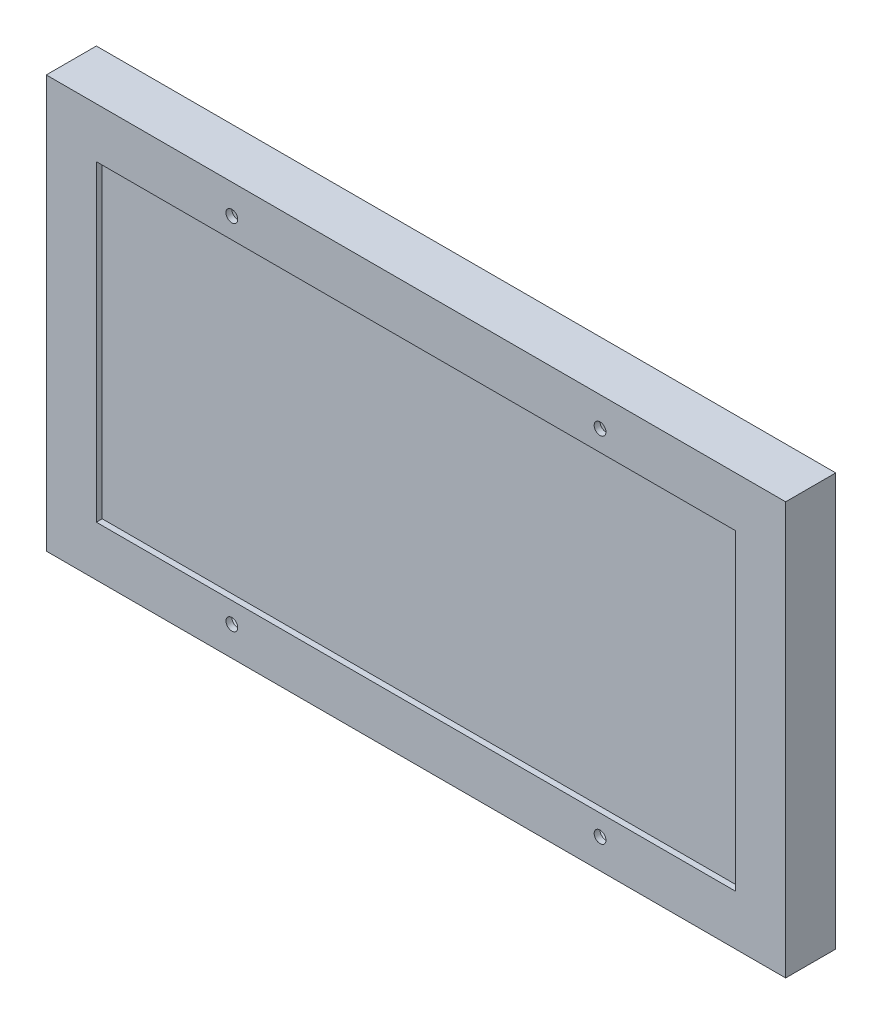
SolidWorks part; units mm, degrees
ref_plane "Front Plane" through (0, 0, 0) normal (0, 0, 1) x (1, 0, 0)
ref_plane "Top Plane" through (0, 0, 0) normal (0, 1, 0) x (1, 0, 0)
ref_plane "Right Plane" through (0, 0, 0) normal (1, 0, 0) x (0, 0, -1)
sketch "Sketch1" plane through (0, 0, 0) normal (0, 0, 1) x (1, 0, 0)
  line L1 (125.5, -70) -> (-125.5, -70)
  line L2 (125.5, -70) -> (125.5, 70)
  line L3 (125.5, 70) -> (-125.5, 70)
  line L4 (-125.5, -70) -> (-125.5, 70)
  line L5 (125.5, -70) -> (-125.5, 70) construction
  line L6 (125.5, 70) -> (-125.5, -70) construction
  point P0 (0, 0)
  dimension "D1" = 251
  dimension "D2" = 140
extrude "Boss-Extrude1" add sketch "Sketch1" along normal blind 17
sketch "Sketch2" plane through (0, 0, 17) normal (0, 0, 1) x (1, 0, 0)
  line L0 (125.5, 70) -> (-125.5, 70) construction
  line L1 (108.5, 53) -> (-108.5, 53)
  line L2 (108.5, 53) -> (108.5, -53)
  line L3 (108.5, -53) -> (-108.5, -53)
  line L4 (-108.5, 53) -> (-108.5, -53)
  line L5 (108.5, 53) -> (-108.5, -53) construction
  line L6 (108.5, -53) -> (-108.5, 53) construction
  line L7 (-125.5, 70) -> (-125.5, -70) construction
  point P0 (0, 0)
  dimension "D1" = 17
  dimension "D2" = 17
extrude "Cut-Extrude1" cut sketch "Sketch2" against normal blind 12.45
sketch "Sketch3" plane through (-108.5, 0, 0) normal (1, 0, 0) x (0, 0, -1)
  line L0 (-4.55, -64.5756) -> (-4.55, 64.2425)
  line L1 (-4.55, 64.2425) -> (-15, 64.2425)
  line L2 (-15, 64.2425) -> (-15, -64.5756)
  line L3 (-15, -64.5756) -> (-4.55, -64.5756)
  line L4 (-17, 53) -> (-17, -53) construction
  line L5 (-4.55, 53) -> (-4.55, -53) construction
  dimension "D1" = 2
extrude "Cut-Extrude2" cut sketch "Sketch3" along normal blind 125.5 and the other way blind 15
mirror "Mirror1" about plane through (0, 0, 0) normal (1, 0, 0) of "Cut-Extrude2"
sketch "Sketch4" plane through (0, 0, 17) normal (0, 0, 1) x (1, 0, 0)
  line L0 (-62.5, 60) -> (-125.5, 60) construction
  line L1 (-125.5, 70) -> (-125.5, -70) construction
  line L2 (62.5, 60) -> (125.5, 60) construction
  line L3 (125.5, -70) -> (125.5, 70) construction
  line L4 (-62.5, 60) -> (-62.5, 70) construction
  line L5 (125.5, 70) -> (-125.5, 70) construction
  line L6 (-62.5, -60) -> (-62.5, 60) construction
  line L7 (-62.5, 60) -> (62.5, 60) construction
  line L8 (62.5, 60) -> (62.5, -60) construction
  line L9 (62.5, -60) -> (-62.5, -60) construction
  line L10 (-62.5, -60) -> (-62.5, -70) construction
  line L11 (-125.5, -70) -> (125.5, -70) construction
  circle A1 centre (-62.5, 60) radius 2
  circle A2 centre (62.5, 60) radius 2
  circle A3 centre (-62.5, -60) radius 2
  circle A4 centre (62.5, -60) radius 2
  dimension "D2" = 4
  dimension "D1" = 125
  dimension "D3" = 120
extrude "Cut-Extrude3" cut sketch "Sketch4" against normal up to next
sketch "Sketch6" plane through (0, 0, 0) normal (0, 0, -1) x (-1, 0, 0)
  text T0 "SolarPanel Surface 3W"
extrude "Cut-Extrude4" cut sketch "Sketch6" against normal blind 0.01
